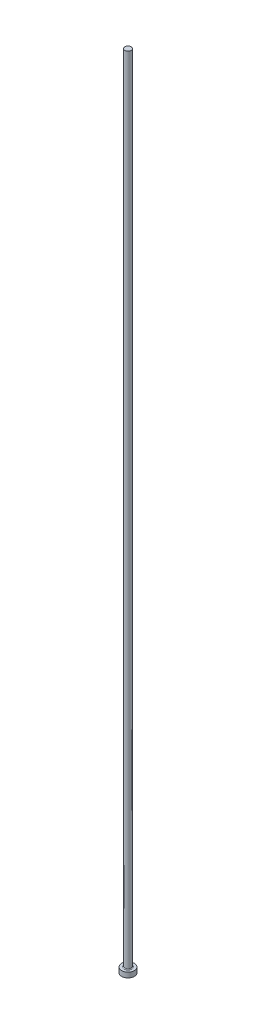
SolidWorks part; units mm, degrees
ref_plane "Plano frontal" through (0, 0, 0) normal (0, 0, 1) x (1, 0, 0)
ref_plane "Plano superior" through (0, 0, 0) normal (0, 1, 0) x (1, 0, 0)
ref_plane "Plano direito" through (0, 0, 0) normal (1, 0, 0) x (0, 0, -1)
sketch "Esboço1" plane through (0, 0, 0) normal (0, 0, 1) x (1, 0, 0)
  line L0 (0, 0) -> (2.5, 0)
  line L1 (2.5, 0) -> (2.5, 2)
  line L2 (2.5, 2) -> (1.55, 2)
  line L3 (1.25, 2.3) -> (1.25, 315)
  line L4 (1.25, 315) -> (0, 315)
  line L5 (0, 315) -> (0, 0) construction
  line L6 (0, 0) -> (0, 315)
  arc A0 (1.55, 2) -> (1.25, 2.3) centre (1.55, 2.3) cw
  dimension "D3" = 0.3
  dimension "D1" = 5
  dimension "D2" = 2.5
  dimension "D4" = 2
  dimension "D5" = 315
revolve "Revolução1" add sketch "Esboço1" angle 360 about L5
sketch "Esboço2"
  dimension "D1" = 0.2812
  dimension "D2" = 0.4375
  dimension "D3" = 0.1875
  dimension "D4" = 1.3438
wrap "Envolver1" sketch "Esboço2" wrap type deboss source sketch "Esboço2" thickness 0.1 parameters "D1"=0.1
